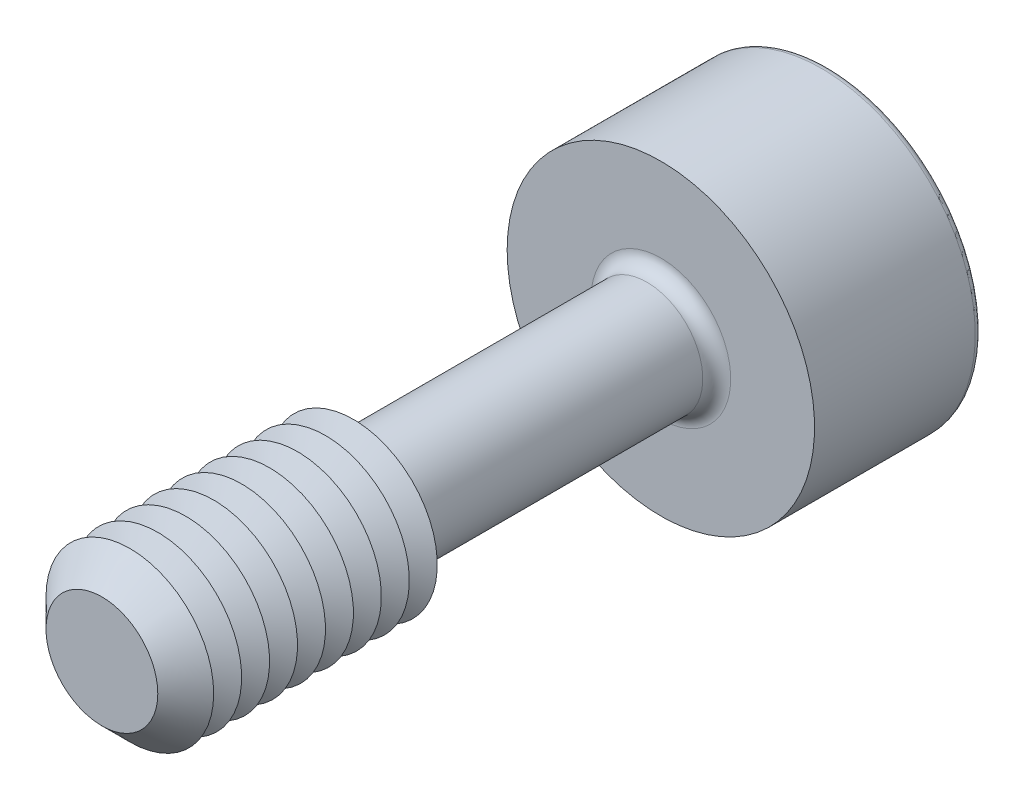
SolidWorks part; units mm, degrees
ref_plane "Front Plane" through (0, 0, 0) normal (0, 0, 1) x (1, 0, 0)
ref_plane "Top Plane" through (0, 0, 0) normal (0, 1, 0) x (1, 0, 0)
ref_plane "Right Plane" through (0, 0, 0) normal (1, 0, 0) x (0, 0, -1)
sketch "Sketch1" plane through (0, 0, 0) normal (0, 0, 1) x (1, 0, 0)
  circle A0 centre (0, 0) radius 1
  dimension "D1" = 2
extrude "Extrude1" add sketch "Sketch1" along normal mid plane 10
sketch "Sketch2" plane through (0, 0, 0) normal (1, 0, 0) x (0, 0, -1)
  line L0 (-5, 0) -> (-5, 1.5)
  line L1 (-5, 1) -> (-5, -1) construction
  line L2 (-5, 1.5) -> (-0.5, 1.5)
  line L3 (-0.5, 1.5) -> (-0.2113, 1)
  line L4 (5, 1) -> (-5, 1) construction
  line L5 (-0.2113, 1) -> (-0.2113, 0)
  line L6 (-0.2113, 0) -> (-5, 0)
  dimension "D1" = 1.5
  dimension "D2" = 120
  dimension "D3" = 4.5
revolve "Revolve1" add sketch "Sketch2" angle 360 about L6
chamfer "Chamfer1" distance 0.5 angle 45 1 edges at (0, 1.5, 5)
sketch "Sketch3" plane through (0, 0, -5) normal (0, 0, -1) x (-1, 0, 0)
  circle A0 centre (0, 0) radius 2.75
  dimension "D1" = 5.5
extrude "Extrude2" add sketch "Sketch3" along normal blind 3
sketch "Sketch4" plane through (-13.7, 0, -8) normal (0, 0, 1) x (1, 0, 0)
  line L2 (12.9783, -1.25) -> (14.4217, -1.25)
  line L3 (14.4217, -1.25) -> (15.1434, 0)
  line L4 (15.1434, 0) -> (14.4217, 1.25)
  line L6 (14.4217, 1.25) -> (12.9783, 1.25)
  line L7 (12.9783, 1.25) -> (12.2566, 0)
  line L8 (12.2566, 0) -> (12.9783, -1.25)
  circle A0 centre (13.7, 0) radius 1.25 construction
  dimension "D1" = 2.5
extrude "Extrude3" cut sketch "Sketch4" along normal blind 2.5
fillet "Fillet1" radius 0.25 1 edges at (-1, 0, -5)
fillet "Fillet2" radius 0.125 1 edges at (-2.75, 0, -8)
sketch "Sketch5" plane through (0, 0, 0) normal (1, 0, 0) x (0, 0, -1)
  line L0 (5.5, 0) -> (5.5, -1.25)
  line L1 (5.5, -1.25) -> (4.7783, 0)
  line L2 (4.7783, 0) -> (5.5, 0)
  dimension "D1" = 30
revolve "Cut-Revolve1" cut sketch "Sketch5" angle 360 about L2
sketch "Sketch6" plane through (0, 0, 0) normal (1, 0, 0) x (0, 0, -1)
  line L0 (1.332, 0) -> (-13.289, 0) construction
sketch "Sketch7" plane through (0, 0, 0) normal (1, 0, 0) x (0, 0, -1)
  line L0 (-0.5, 1.5) -> (-0.75, 1.067)
  line L1 (-0.75, 1.067) -> (-1, 1.5)
  line L2 (-0.5, 1.5) -> (-4.5, 1.5) construction
  line L3 (-1, 1.5) -> (-0.5, 1.5)
  dimension "D1" = 0.5
revolve "Cut-Revolve2" cut sketch "Sketch7" angle 360 about L0
pattern_linear "LPattern1" count 8 spacing 0.5 along (0, 0, 1) of "Cut-Revolve2"
